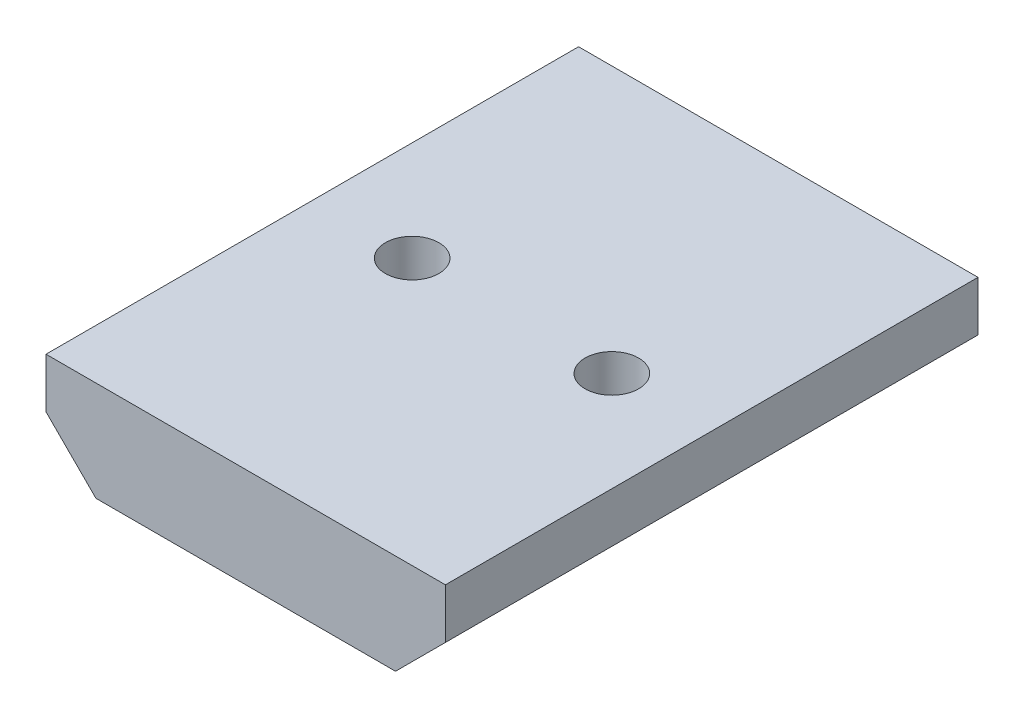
SolidWorks part; units mm, degrees
ref_plane "Front Plane" through (0, 0, 0) normal (0, 0, 1) x (1, 0, 0)
ref_plane "Top Plane" through (0, 0, 0) normal (0, 1, 0) x (1, 0, 0)
ref_plane "Right Plane" through (0, 0, 0) normal (1, 0, 0) x (0, 0, -1)
sketch "Sketch1" plane through (0, 0, 0) normal (0, 1, 0) x (1, 0, 0)
  line L1 (-19.05, 25.4) -> (19.05, 25.4)
  line L2 (-19.05, 25.4) -> (-19.05, -25.4)
  line L3 (-19.05, -25.4) -> (19.05, -25.4)
  line L4 (19.05, 25.4) -> (19.05, -25.4)
  line L5 (-19.05, 25.4) -> (19.05, -25.4) construction
  line L6 (-19.05, -25.4) -> (19.05, 25.4) construction
  point P0 (0, 0)
  dimension "D1" = 38.1
  dimension "D2" = 50.8
extrude "Boss-Extrude1" add sketch "Sketch1" along normal mid plane 9.525
hole_wizard "CBORE for #10 Socket Head Cap Screw1" positions "Sketch4" profile "Sketch5" counterbore size "#10" standard "ANSI Inch"
sketch "Sketch4" plane through (0, -4.7625, 0) normal (0, -1, 0) x (-1, 0, 0)
  line L0 (0, -25.4) -> (0, -36.9306) construction
  line L1 (19.05, -25.4) -> (-19.05, -25.4) construction
  line L3 (-9.525, 0) -> (-19.05, 0) construction
  line L4 (-19.05, -25.4) -> (-19.05, 25.4) construction
  point P0 (-9.525, 0)
  point P2 (9.525, 0)
  dimension "D1" = 9.525
sketch "Sketch5" plane through (9.525, -4.7625, 0) normal (1, 0, 0) x (0, 0, -1)
  line L0 (0, 0) -> (0, 9.525)
  line L1 (0, 9.525) -> (2.5527, 9.525)
  line L3 (2.5527, 9.525) -> (2.5527, 4.826)
  line L4 (2.5527, 4.826) -> (4.7625, 4.826)
  line L5 (4.7625, 4.826) -> (4.7625, 0)
  line L7 (4.7625, 0) -> (0, 0)
  line L11 (0, -6.35) -> (0, 107.95) construction
  dimension "Thru Hole Dia." = 5.1054
  dimension "Thru Hole Depth" = 9.525
  dimension "C'Bore Dia." = 9.525
  dimension "C'Bore Depth" = 4.826
chamfer "Chamfer1" distance 4.7625 angle 45 2 edges at (19.05, -4.7625, 0) (-19.05, -4.7625, 0)
